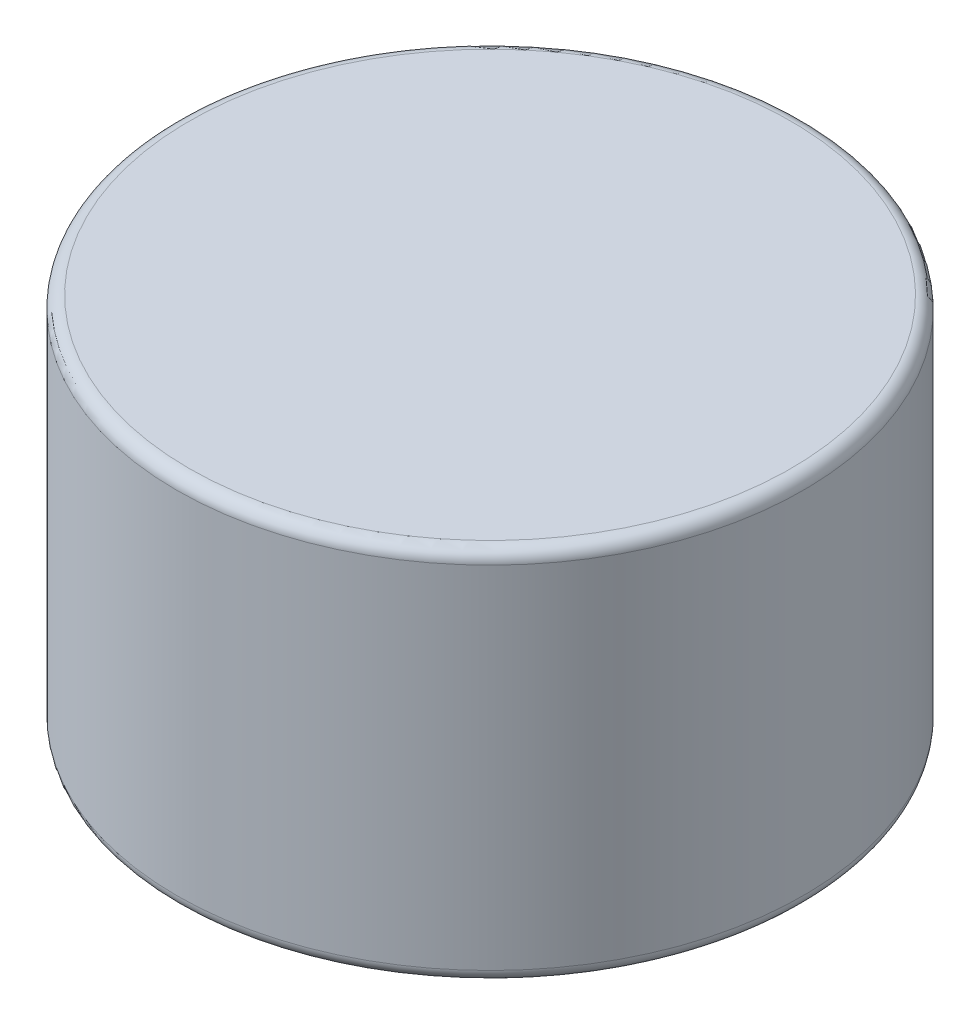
SolidWorks part; units mm, degrees
ref_plane "Спереди" through (0, 0, 0) normal (0, 0, 1) x (1, 0, 0)
ref_plane "Сверху" through (0, 0, 0) normal (0, 1, 0) x (1, 0, 0)
ref_plane "Справа" through (0, 0, 0) normal (1, 0, 0) x (0, 0, -1)
sketch "Эскиз1" plane through (0, 0, 0) normal (0, 1, 0) x (1, 0, 0)
  circle A0 centre (0, 0) radius 2.5
  dimension "D1" = 5
extrude "Бобышка-Вытянуть1" add sketch "Эскиз1" along normal blind 3
fillet "Скругление1" radius 0.1 2 edges at (0, 0, 2.5) (0, 3, 2.5)
